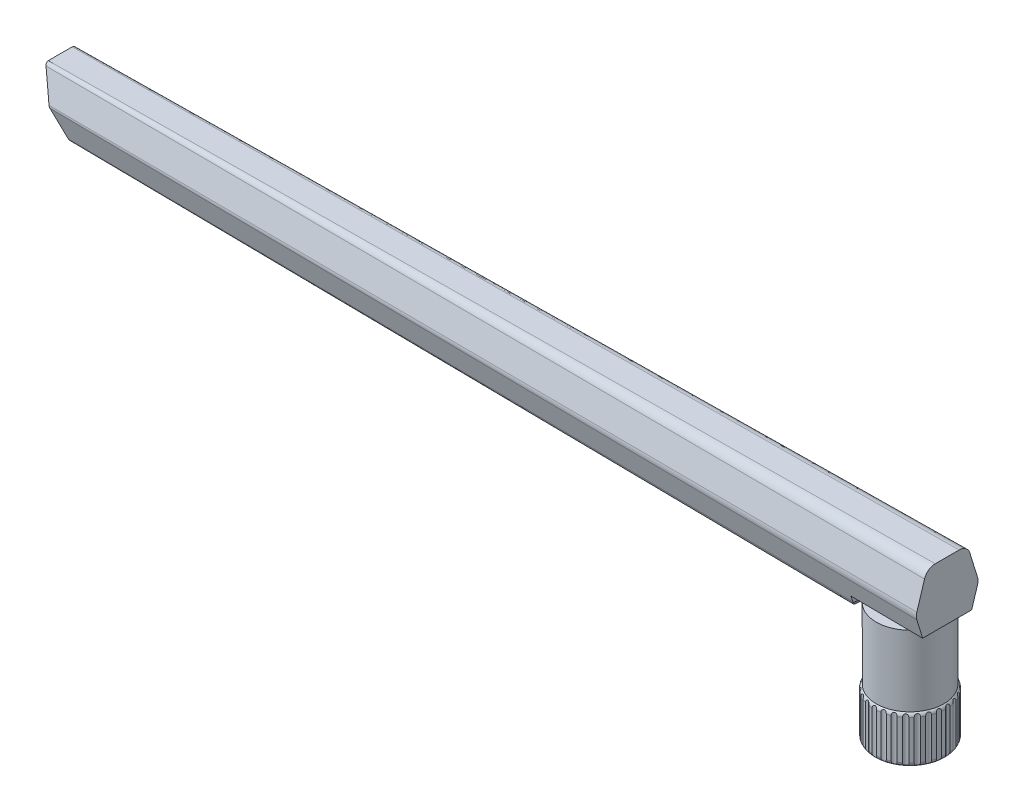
SolidWorks part; units mm, degrees
ref_plane "Front Plane" through (0, 0, 0) normal (0, 0, 1) x (1, 0, 0)
ref_plane "Top Plane" through (0, 0, 0) normal (0, 1, 0) x (1, 0, 0)
ref_plane "Right Plane" through (0, 0, 0) normal (1, 0, 0) x (0, 0, -1)
sketch "Sketch2" plane through (0, 0, 0) normal (1, 0, 0) x (0, 0, -1)
  line L0 (-2.648, 0) -> (-4.2481, 0) construction
  line L1 (-2.1798, -5.1689) -> (2.1798, -5.1689)
  line L2 (-2.648, -5.1689) -> (-2.648, 5.1689) construction
  line L3 (-2.1798, 5.1689) -> (2.1798, 5.1689)
  line L4 (2.6479, -5.1689) -> (2.6479, 5.1689) construction
  line L5 (-2.648, -5.1689) -> (2.6479, 5.1689) construction
  line L6 (-2.648, 5.1689) -> (2.6479, -5.1689) construction
  line L7 (-4.19, 0.1878) -> (-2.7864, 4.7217)
  line L8 (-4.19, -0.1878) -> (-2.7864, -4.7217)
  line L9 (2.6479, 0) -> (4.2481, 0) construction
  line L10 (2.7864, 4.7217) -> (4.19, 0.1878)
  line L11 (4.19, -0.1878) -> (2.7864, -4.7217)
  arc A0 (2.1798, 5.1689) -> (2.7864, 4.7217) centre (2.1798, 4.5339) cw
  arc A1 (4.19, 0.1878) -> (4.19, -0.1878) centre (3.5834, 0) cw
  arc A2 (2.7864, -4.7217) -> (2.1798, -5.1689) centre (2.1798, -4.5339) cw
  arc A3 (-2.1798, -5.1689) -> (-2.7864, -4.7217) centre (-2.1798, -4.5339) cw
  arc A4 (-4.19, -0.1878) -> (-4.19, 0.1878) centre (-3.5834, 0) cw
  arc A5 (-2.7864, 4.7217) -> (-2.1798, 5.1689) centre (-2.1798, 4.5339) cw
  point P0 (0, 0)
  dimension "D4" = 0.635
  dimension "D1" = 10.3378
  dimension "D2" = 8.4963
  dimension "D3" = 5.2959
extrude "Boss-Extrude1" add sketch "Sketch2" along normal blind 161.925 draft 0.5
sketch "Sketch3" plane through (0, 0, 0) normal (0, 0, 1) x (1, 0, 0)
  line L0 (0, 5.1689) -> (4.5085, -5.2082)
  line L1 (161.925, -6.582) -> (0, -5.1689) construction
  line L2 (4.5085, -5.2082) -> (0, -5.1689)
  line L3 (0, -5.1689) -> (0, 5.1689)
  line L4 (148.717, -5.312) -> (147.955, -6.4601)
  line L5 (161.925, -6.582) -> (148.717, -6.582)
  line L6 (161.925, -6.582) -> (161.925, -4.042)
  line L7 (161.925, -4.042) -> (148.717, -4.042)
  line L8 (148.717, -5.312) -> (148.717, -4.042)
  line L9 (147.955, -6.4601) -> (148.717, -6.582)
  dimension "D1" = 4.5085
  dimension "D2" = 13.208
  dimension "D3" = 2.54
  dimension "D4" = 0.762
  dimension "D5" = 1.27
extrude "Cut-Extrude1" cut sketch "Sketch3" against normal through all and the other way through all
sketch "Sketch4" plane through (0, -4.042, 0) normal (0, -1, 0) x (1, 0, 0)
  line L0 (161.925, 0) -> (155.1454, 0) construction
  line L1 (161.925, 4.4761) -> (161.925, -4.4761) construction
  circle A0 centre (155.1454, 0) radius 6.1722
  dimension "D1" = 12.3444
  dimension "D2" = 6.7796
extrude "Boss-Extrude2" add sketch "Sketch4" along normal blind 12.9159
sketch "Sketch5" plane through (0, -16.9579, 0) normal (0, -1, 0) x (1, 0, 0)
  circle A0 centre (155.1454, 0) radius 6.5278
  dimension "D1" = 13.0556
extrude "Boss-Extrude3" add sketch "Sketch5" along normal blind 8.5979
fillet "Fillet1" radius 0.762 2 edges at (161.6732, -16.9579, 0) (161.6732, -25.5558, 0)
sketch "Sketch6" plane through (0, -25.5558, 0) normal (0, -1, 0) x (1, 0, 0)
  circle A0 centre (155.1454, 0) radius 2.7749
  dimension "D1" = 5.5499
extrude "Cut-Extrude2" cut sketch "Sketch6" against normal blind 3.3528
sketch "Sketch7" plane through (0, -22.203, 0) normal (0, -1, 0) x (1, 0, 0)
  circle A0 centre (155.1454, 0) radius 0.635
  dimension "D1" = 1.27
extrude "Cut-Extrude3" cut sketch "Sketch7" against normal blind 7.62
sketch "Sketch8" plane through (0, -22.203, 0) normal (0, -1, 0) x (1, 0, 0)
  circle A0 centre (155.1454, 0) radius 0.635 construction
  circle A1 centre (155.1454, 0) radius 0.635
  circle A2 centre (155.1454, 0) radius 1.778
  dimension "D1" = 3.556
extrude "Boss-Extrude4" add sketch "Sketch8" along normal blind 1.27
chamfer "Chamfer1" distance 0.508 angle 45 1 edges at (157.9204, -25.5558, 0)
sketch "Sketch9" plane through (0, -25.5558, 0) normal (0, -1, 0) x (1, 0, 0)
  line L0 (155.1454, 0) -> (155.1454, 6.9975) construction
  circle A0 centre (155.1454, 6.9975) radius 0.635
  dimension "D1" = 1.27
  dimension "D2" = 6.9975
extrude "Cut-Extrude4" cut sketch "Sketch9" against normal blind 11.43
pattern_circular "CirPattern1" count 27 over 360 about axis through (155.1454, 0, 0) along (0, 1, 0) of "Cut-Extrude4"
